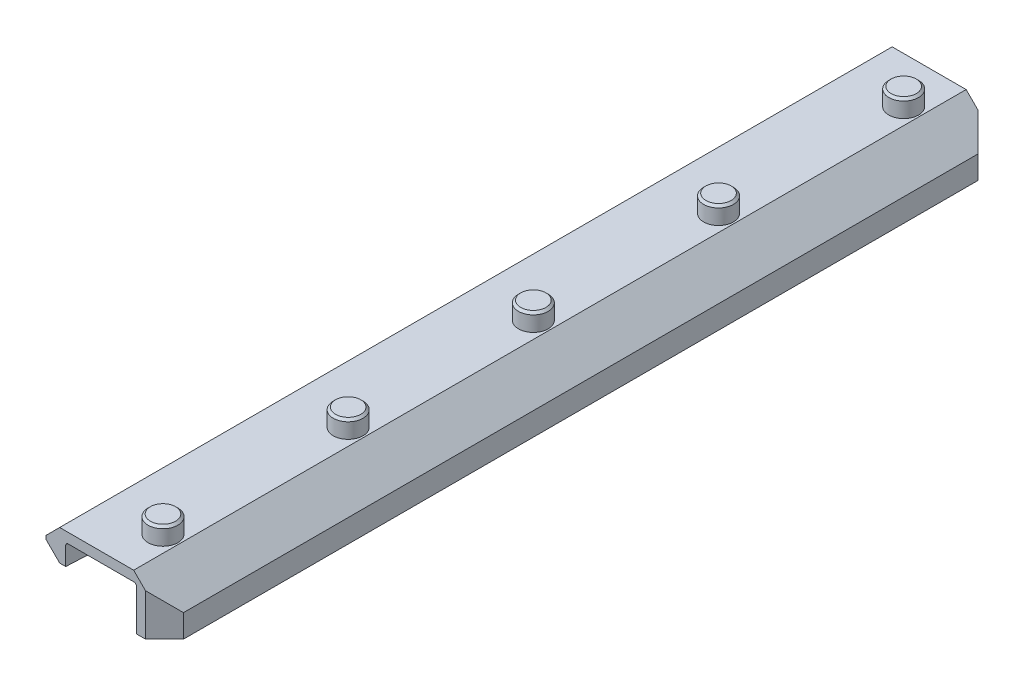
SolidWorks part; units mm, degrees
ref_plane "Front Plane" through (0, 0, 0) normal (0, 0, 1) x (1, 0, 0)
ref_plane "Top Plane" through (0, 0, 0) normal (0, 1, 0) x (1, 0, 0)
ref_plane "Right Plane" through (0, 0, 0) normal (1, 0, 0) x (0, 0, -1)
sketch "Sketch1" plane through (0, 0, 0) normal (0, 0, 1) x (1, 0, 0)
  line L0 (-7.62, 4.5) -> (4.7498, 4.5)
  line L1 (-9.906, -4.5) -> (9.906, -4.5) construction
  line L2 (-9.906, -4.5) -> (-9.906, 4.5) construction
  line L3 (-9.906, 4.5) -> (9.906, 4.5) construction
  line L4 (9.906, -4.5) -> (9.906, 4.5) construction
  line L5 (-9.906, -4.5) -> (9.906, 4.5) construction
  line L6 (-9.906, 4.5) -> (9.906, -4.5) construction
  line L7 (9.906, -0.6562) -> (9.906, -4.5)
  line L8 (9.906, -4.5) -> (4.699, -4.5)
  line L9 (4.699, -4.5) -> (4.699, 2.8236)
  line L10 (4.699, 2.8236) -> (-6.096, 2.8236)
  line L11 (-6.096, 2.8236) -> (-6.096, -0.6562)
  line L12 (-6.096, -0.6562) -> (-7.62, -0.6562)
  line L13 (-9.906, 1.6298) -> (-9.906, 2.214)
  line L14 (4.7498, 4.5) -> (9.906, -0.6562)
  line L15 (-9.906, 2.214) -> (-7.62, 4.5)
  line L16 (-7.62, -0.6562) -> (-9.906, 1.6298)
  point P0 (0, 0)
  point P11 (-9.906, -0.6562)
  point P22 (4.699, -4.5)
  dimension "D1" = 9
  dimension "D2" = 19.812
  dimension "D3" = 1.6764
  dimension "D4" = 5.207
  dimension "D5" = 3.81
  dimension "D6" = 5.1562
extrude "Boss-Extrude1" add sketch "Sketch1" along normal blind 139.192
chamfer "Chamfer1" distance 11.0998 distance2 0.508 2 edges at (4.699, -0.8382, 139.192) (-6.096, 1.0837, 139.192)
chamfer "Chamfer2" distance 0.508 distance2 11.0998 2 edges at (4.699, -0.8382, 0) (-6.096, 1.0837, 0)
chamfer "Chamfer3" distance 3.175 angle 45 2 edges at (9.906, -2.5781, 0) (9.906, -2.5781, 139.192)
sketch "Sketch2" plane through (0, 4.5, 0) normal (0, 1, 0) x (1, 0, 0)
  line L0 (1.9812, 0.0003) -> (1.9812, -108.5342) construction
  line L4 (9.906, -136.017) -> (9.906, -3.175) construction
  line L5 (-9.906, -69.596) -> (9.906, -69.596) construction
  line L6 (-9.906, -139.192) -> (-9.906, 0) construction
  circle A0 centre (1.9812, -7.6708) radius 2.4892
  circle A1 centre (1.9812, -38.6334) radius 2.4892
  circle A2 centre (1.9812, -100.5586) radius 2.4892
  circle A3 centre (1.9812, -131.5212) radius 2.4892
  circle A4 centre (1.9812, -69.596) radius 2.4892
  dimension "D5" = 4.9784
  dimension "D1" = 7.9248
  dimension "D2" = 30.9626
  dimension "D3" = 30.9626
  dimension "D4" = 30.9626
extrude "Boss-Extrude2" add sketch "Sketch2" along normal blind 2.921
chamfer "Chamfer4" distance 0.381 angle 45 5 edges at (1.9812, 7.421, 134.0104) (1.9812, 7.421, 103.0478) (1.9812, 7.421, 41.1226) (1.9812, 7.421, 10.16) (1.9812, 7.421, 72.0852)
fillet "Fillet1" radius 0.381 6 edges at (4.699, 2.8236, 69.596) (-6.096, 2.8236, 69.596) (4.953, 2.8236, 5.5499) (-6.35, 2.8236, 5.5499) (-6.35, 2.8236, 133.6421) (4.953, 2.8236, 133.6421)
